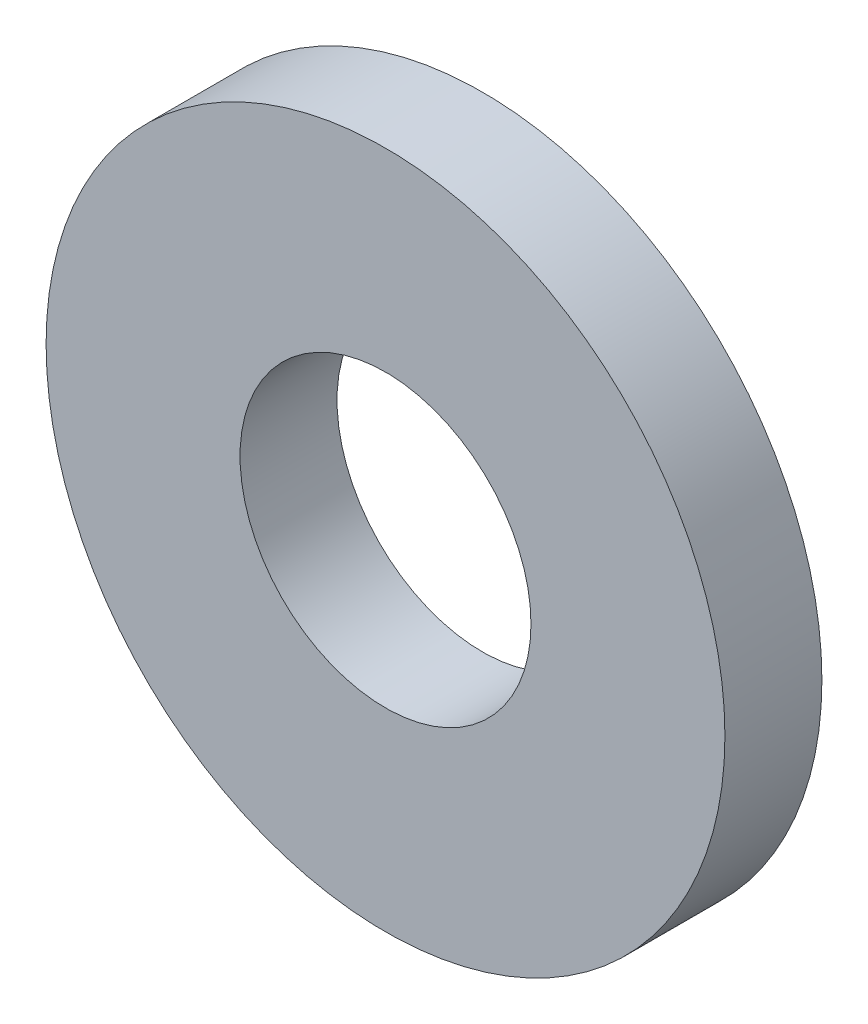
SolidWorks part; units mm, degrees
ref_plane "Plan de face" through (0, 0, 0) normal (0, 0, 1) x (1, 0, 0)
ref_plane "Plan de dessus" through (0, 0, 0) normal (0, 1, 0) x (1, 0, 0)
ref_plane "Plan de droite" through (0, 0, 0) normal (1, 0, 0) x (0, 0, -1)
sketch "Esquisse1" plane through (0, 0, 0) normal (0, 0, 1) x (1, 0, 0)
  circle A0 centre (11.35, -4) radius 0.75 construction
  circle A1 centre (11.35, -4) radius 0.75
  circle A2 centre (11.35, -4) radius 1.75
  dimension "D1" = 3.5
extrude "Extrusion1" add sketch "Esquisse1" along normal blind 0.5
